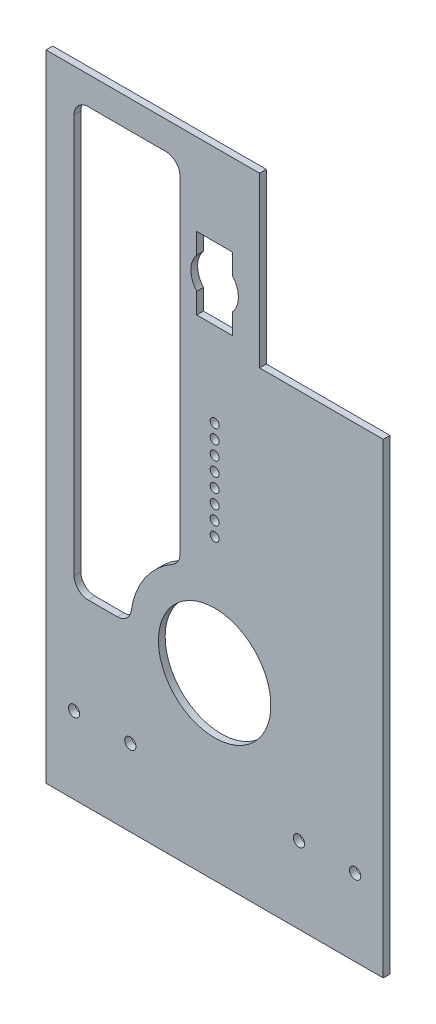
SolidWorks part; units mm, degrees
ref_plane "Front Plane" through (0, 0, 0) normal (0, 0, 1) x (1, 0, 0)
ref_plane "Top Plane" through (0, 0, 0) normal (0, 1, 0) x (1, 0, 0)
ref_plane "Right Plane" through (0, 0, 0) normal (1, 0, 0) x (0, 0, -1)
sketch "Sketch1" plane through (0, 0, 0) normal (0, 0, 1) x (1, 0, 0)
  line L1 (-76.2, 146.05) -> (76.2, 146.05)
  line L2 (-76.2, 146.05) -> (-76.2, -146.05)
  line L3 (-76.2, -146.05) -> (76.2, -146.05)
  line L4 (76.2, 146.05) -> (76.2, -146.05)
  line L5 (-76.2, 146.05) -> (76.2, -146.05) construction
  line L6 (-76.2, -146.05) -> (76.2, 146.05) construction
  point P0 (0, 0)
  dimension "D1" = 152.4
  dimension "D2" = 292.1
extrude "Boss-Extrude1" add sketch "Sketch1" along normal blind 3.048
sketch "Sketch2" plane through (0, 0, 0) normal (0, 0, 1) x (1, 0, 0)
  line L0 (-76.2, -146.05) -> (76.2, -146.05) construction
  line L1 (-76.2, -146.05) -> (76.2, -146.05) construction
  line L3 (8.0869, 109.0549) -> (-8.0869, 109.0549)
  line L4 (8.0869, 109.0549) -> (8.0869, 76.3651)
  line L5 (8.0869, 76.3651) -> (-8.0869, 76.3651)
  line L6 (-8.0869, 109.0549) -> (-8.0869, 76.3651)
  line L7 (8.0869, 109.0549) -> (-8.0869, 76.3651) construction
  line L8 (8.0869, 76.3651) -> (-8.0869, 109.0549) construction
  circle A0 centre (0, -59.69) radius 25.4
  circle A1 centre (0, 92.71) radius 10.7315
  circle A2 centre (0, 38.1) radius 2.0193
  circle A3 centre (0, 31.75) radius 2.0193
  circle A4 centre (0, 25.4) radius 2.0193
  circle A5 centre (0, 19.05) radius 2.0193
  circle A6 centre (0, 12.7) radius 2.0193
  circle A7 centre (0, 6.35) radius 2.0193
  circle A8 centre (0, 0) radius 2.0193
  circle A9 centre (0, -6.35) radius 2.0193
  dimension "D1" = 50.8
  dimension "D3" = 21.463
  dimension "D5" = 4.0386
  dimension "D7" = 184.15
  dimension "D2" = 86.36
  dimension "D4" = 152.4
  dimension "D8" = 16.1738
  dimension "D9" = 32.6898
  dimension "D6" = 8
extrude "Cut-Extrude1" cut sketch "Sketch2" along normal through all contours L6 A1 | A3 | A2 | A4 | A5 | A6 | A7 | A8 | A9 | A0
sketch "Sketch4" plane through (0, 0, 0) normal (0, 0, 1) x (1, 0, 0)
  line L1 (76.2, 146.05) -> (20.32, 146.05)
  line L2 (76.2, 146.05) -> (76.2, 69.85)
  line L3 (76.2, 69.85) -> (20.32, 69.85)
  line L4 (20.32, 146.05) -> (20.32, 69.85)
  dimension "D1" = 55.88
  dimension "D2" = 76.2
extrude "Cut-Extrude2" cut sketch "Sketch4" along normal through all
sketch "Sketch5" plane through (0, 0, 0) normal (0, 0, -1) x (-1, 0, 0)
  line L0 (76.2, -146.05) -> (-76.2, -146.05) construction
  line L1 (-76.2, -146.05) -> (-76.2, 69.85) construction
  line L2 (0, 1.6764) -> (0, -1.6764) construction
  circle A0 centre (-38.1, -106.299) radius 2.54
  circle A2 centre (-63.5, -106.299) radius 2.54
  circle A3 centre (63.5, -106.299) radius 2.54
  circle A4 centre (38.1, -106.299) radius 2.54
  dimension "D1" = 5.08
  dimension "D2" = 39.751
  dimension "D3" = 25.4
  dimension "D4" = 12.7
extrude "Cut-Extrude3" cut sketch "Sketch5" against normal through all
sketch "Sketch6" plane through (0, 0, 0) normal (0, 0, -1) x (-1, 0, 0)
  line L0 (76.2, 146.05) -> (76.2, -146.05) construction
  line L1 (-76.2, -146.05) -> (76.2, -146.05)
  line L2 (-76.2, -146.05) -> (-76.2, -140.97)
  line L3 (-76.2, -140.97) -> (76.2, -140.97)
  line L4 (76.2, -146.05) -> (76.2, -140.97)
  dimension "D1" = 5.08
extrude "Cut-Extrude4" cut sketch "Sketch6" against normal through all
sketch "Sketch7" plane through (0, 0, 0) normal (0, 0, -1) x (-1, 0, 0)
  line L6 (15.6712, 133.35) -> (15.6712, -24.9622)
  line L7 (38.1, -59.69) -> (63.9817, -59.69)
  line L9 (63.5, -128.27) -> (-76.2, -128.27)
  line L10 (-20.32, 133.35) -> (63.5, 133.35)
  line L11 (63.5, 133.35) -> (63.5, -128.27)
  line L13 (15.6712, 133.35) -> (63.5, 133.35)
  line L14 (63.5, 133.35) -> (63.5, -59.69)
  circle A5 centre (0, -59.69) radius 38.1
  circle A6 centre (0, -59.69) radius 38.1
  dimension "D1" = 12.7
  dimension "D2" = 12.7
extrude "Cut-Extrude5" cut sketch "Sketch7" against normal blind 6.35 contours A6 L7 L14 L13 L6
fillet "Fillet1" radius 6.35 5 edges at (-38.1, -59.69, 1.524) (-15.6712, -24.9622, 1.524) (-63.5, -59.69, 1.524) (-63.5, 133.35, 1.524) (-15.6712, 133.35, 1.524)
equation "\"thickness_acrylic0.1\"=0.1in"
equation "\"motor offset\"=6mm"
equation "\"thickness0.25\"=0.225in"
equation "\"thickness0.125\"=0.122in"
